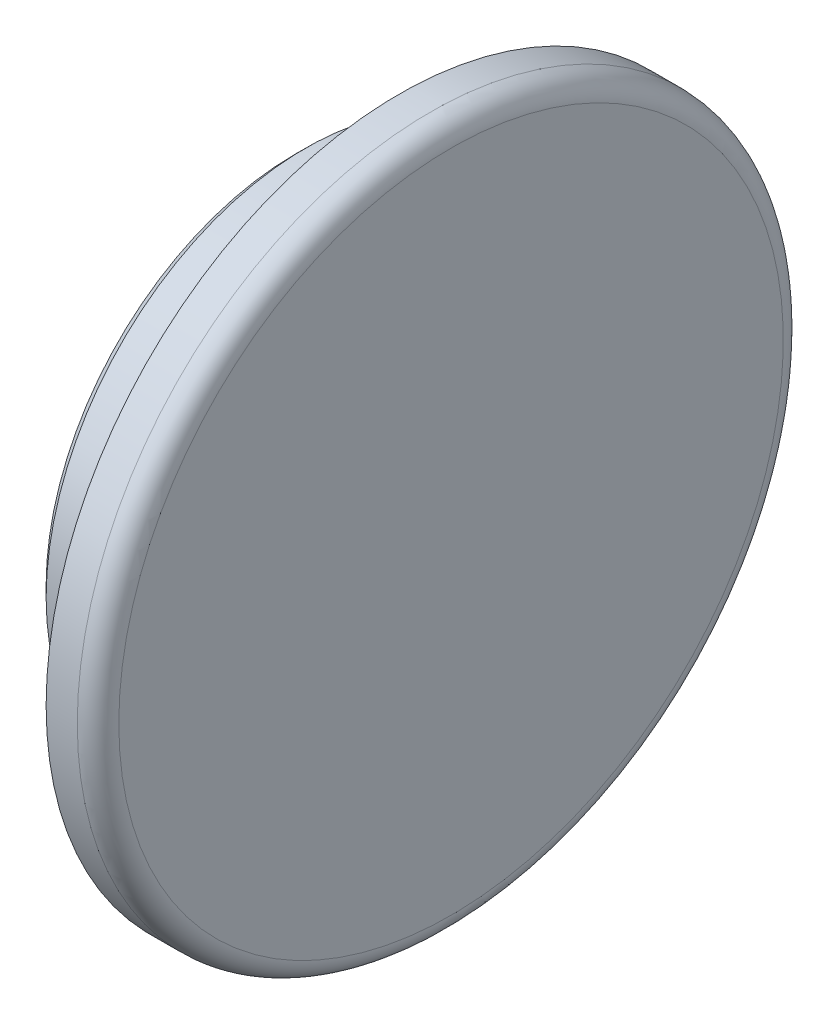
SolidWorks part; units mm, degrees
ref_plane "Front Plane" through (0, 0, 0) normal (0, 0, 1) x (1, 0, 0)
ref_plane "Top Plane" through (0, 0, 0) normal (0, 1, 0) x (1, 0, 0)
ref_plane "Right Plane" through (0, 0, 0) normal (1, 0, 0) x (0, 0, -1)
sketch "Esquisse1" plane through (0, 0, 0) normal (0, 0, 1) x (1, 0, 0)
  line L0 (0, 12.5) -> (5, 12.5)
  line L1 (5, 10.5) -> (5, 0)
  line L2 (0, 10.5) -> (5, 10.5)
  line L3 (7.5, 0) -> (7.5, 17)
  line L4 (5, 12.5) -> (5, 17)
  line L5 (0, 10.5) -> (0, 12.5)
  line L6 (-7.2154, 0) -> (12.7386, 0) construction
  line L7 (5, 17) -> (7.5, 17)
  line L8 (5, 0) -> (7.5, 0)
  dimension "D1" = 2.5
  dimension "D2" = 2
  dimension "D3" = 12.5
  dimension "D4" = 17
  dimension "D5" = 5
revolve "Révolution1" add sketch "Esquisse1" angle 360 about L6
fillet "Congé1" radius 1 1 edges at (7.5, 0, 17)
chamfer "Chanfrein1" distance 0.5 angle 45 1 edges at (0, 0, 12.5)
